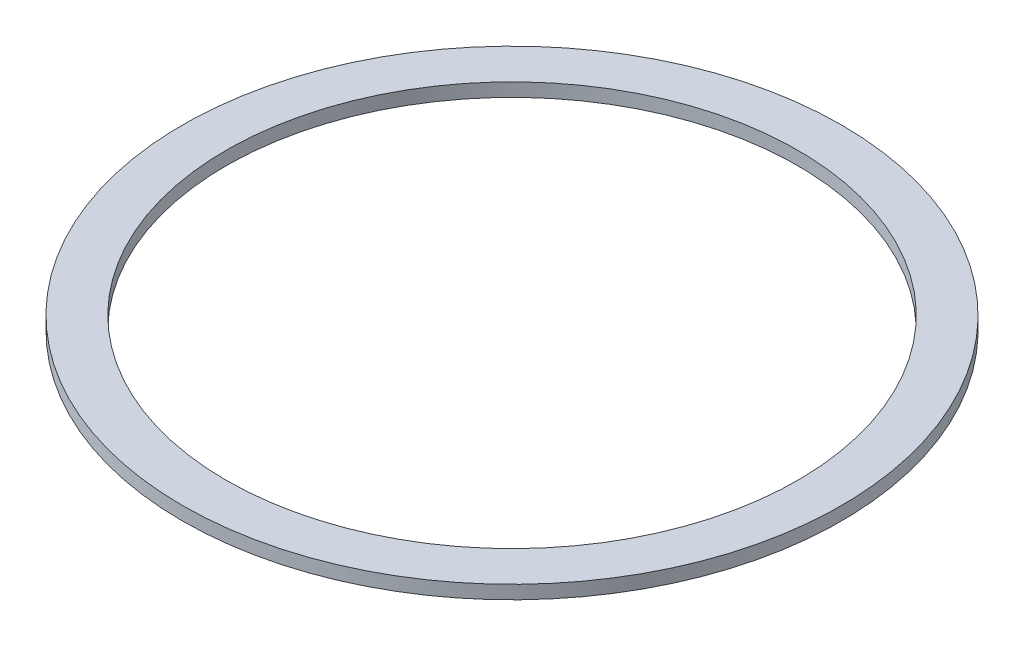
SolidWorks part; units mm, degrees
ref_plane "Front Plane" through (0, 0, 0) normal (0, 0, 1) x (1, 0, 0)
ref_plane "Top Plane" through (0, 0, 0) normal (0, 1, 0) x (1, 0, 0)
ref_plane "Right Plane" through (0, 0, 0) normal (1, 0, 0) x (0, 0, -1)
sketch "Schizzo1" plane through (0, 0, 0) normal (0, 1, 0) x (1, 0, 0)
  circle A0 centre (0, 0) radius 98
  circle A1 centre (0, 0) radius 85
  dimension "D1" = 170
  dimension "D2" = 196
extrude "Estrusione-Estrusione1" add sketch "Schizzo1" along normal blind 4
